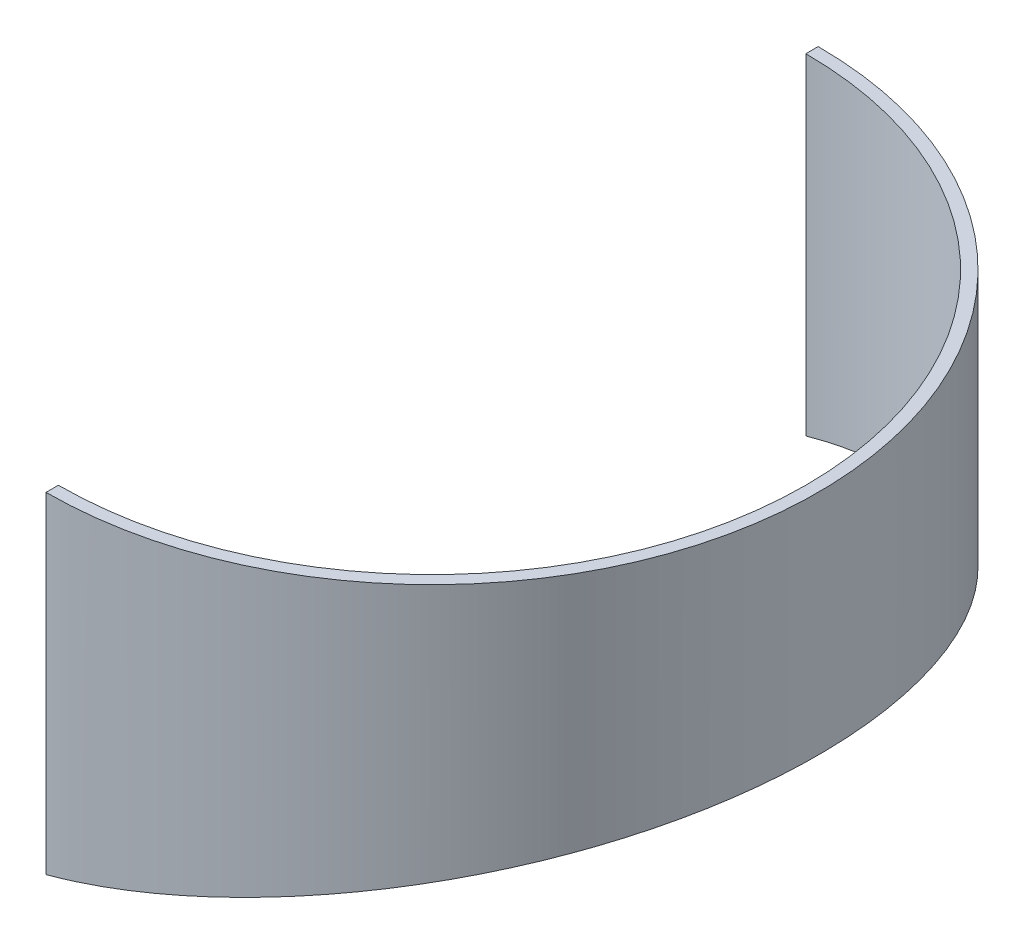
SolidWorks part; units mm, degrees
ref_plane "前视基准面" through (0, 0, 0) normal (0, 0, 1) x (1, 0, 0)
ref_plane "上视基准面" through (0, 0, 0) normal (0, 1, 0) x (1, 0, 0)
ref_plane "右视基准面" through (0, 0, 0) normal (1, 0, 0) x (0, 0, -1)
imported_body "基体零件-人字形三通管-1"
sheet metal parameters "钣金1" parameters "D1"=0.7366, "厚度"=8
bend "圆角折弯1" bend radius 242 bend angle 180 parameters "D5"=1
flatten bends "展开-折弯1"
sketch "尖角-草图1" plane through (0, -107.1797, 250) normal (0, 0, 1) x (1, 0, 0)
  line L0 (380.1327, 107.1797) -> (380.1327, -107.1797) construction
  dimension "D1" = 0
process bends "加工-折弯1" parameters "D1"=0
sketch "平面-草图1" plane through (0, -107.1797, 250) normal (0, 0, 1) x (1, 0, 0)
